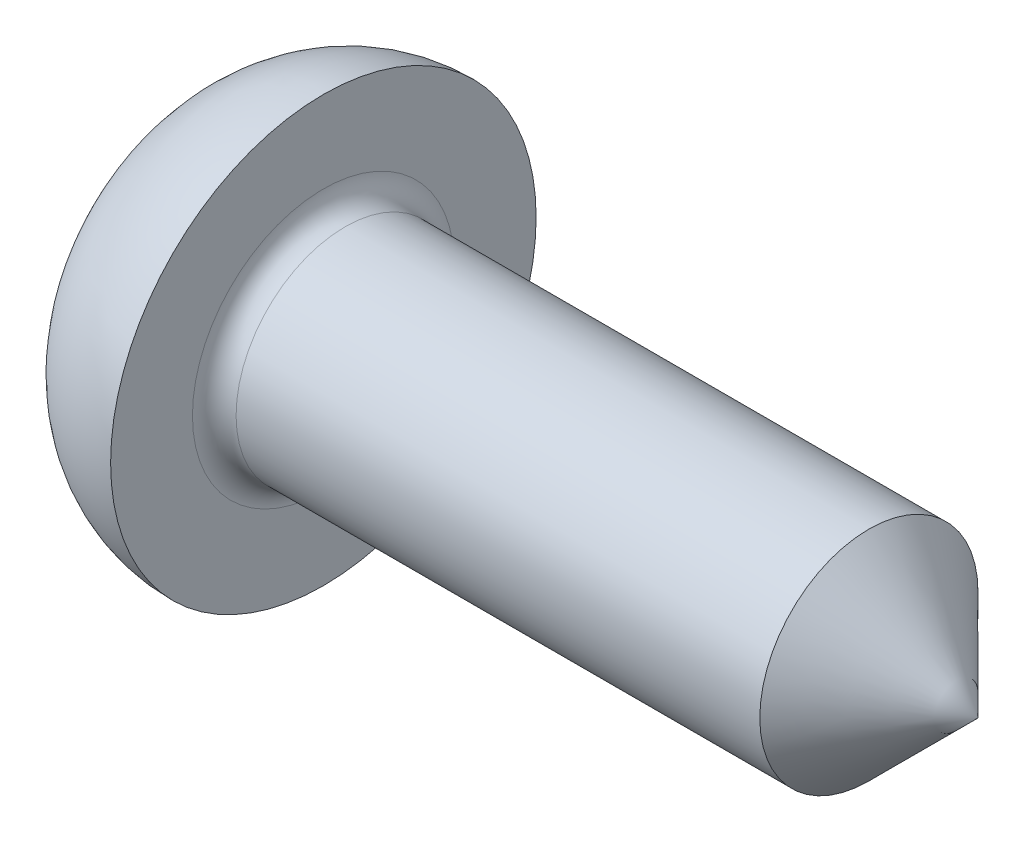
SolidWorks part; units mm, degrees
ref_plane "Front" through (0, 0, 0) normal (0, 0, 1) x (1, 0, 0)
ref_plane "Top" through (0, 0, 0) normal (0, 1, 0) x (1, 0, 0)
ref_plane "Right" through (0, 0, 0) normal (1, 0, 0) x (0, 0, -1)
sketch "Sketch1" plane through (0, 0, 0) normal (0, 1, 0) x (1, 0, 0)
  line L0 (-13.6293, 0) -> (11.3577, 0) construction
  line L1 (1.6, 1) -> (7.6, 1)
  line L2 (7.6, 1) -> (7.6, 0)
  line L3 (1.6, 1) -> (1.6, 1.95)
  line L4 (7.6, 0) -> (0, 0)
  arc A0 (1.6, 1.95) -> (0.4796, 1.4057) centre (1.5877, 0.5501) ccw
  arc A1 (0, 0) -> (0.4796, 1.4057) centre (2.3, 0) cw
  dimension "r2" = 1.4
  dimension "r1" = 2.3
  dimension "d" = 2
  dimension "dk" = 3.9
  dimension "k" = 1.6
  dimension "l" = 6
revolve "Revolve1" add sketch "Sketch1" angle 360 about L0
fillet "Fillet2" radius 0.2 1 edges at (1.6, 0, 1)
sketch "Sketch4" plane through (0, 0, 0) normal (0, 1, 0) x (1, 0, 0)
  line L0 (4.7828, 0) -> (7.1391, 0) construction
  line L2 (8.3335, 0) -> (8.3335, 21)
  line L3 (8.3335, 21) -> (-13.4, 21)
  line L4 (-13.4, 21) -> (7.6, 0)
  line L5 (7.6, 0) -> (8.3335, 0)
  line L7 (7.6, -1) -> (7.6, 1) construction
  dimension "D1" = 45
  dimension "D2" = 0.7335
  dimension "D3" = 21
revolve "Cut-Revolve1" cut sketch "Sketch4" angle 360 about L0
sketch "Sketch2" plane through (0, 0, 0) normal (1, 0, 0) x (0, 0, -1)
  line L0 (-2.278, 0) -> (2.6944, 0) construction
  line L1 (0, -2.1234) -> (0, 2.1948) construction
  line L2 (-0.3125, 0.3125) -> (-1.25, 0.3125)
  line L3 (0.3125, -1.25) -> (-0.3125, -1.25)
  line L4 (0.3125, -1.25) -> (0.3125, -0.3125)
  line L5 (0.3125, 1.25) -> (-0.3125, 1.25)
  line L6 (-0.3125, -1.25) -> (-0.3125, -0.3125)
  line L7 (1.25, 0.3125) -> (0.3125, 0.3125)
  line L8 (1.25, 0.3125) -> (1.25, -0.3125)
  line L9 (1.25, -0.3125) -> (0.3125, -0.3125)
  line L10 (-1.25, 0.3125) -> (-1.25, -0.3125)
  line L11 (-0.3125, 0.3125) -> (-0.3125, 1.25)
  line L12 (-0.3125, -0.3125) -> (-1.25, -0.3125)
  line L13 (0.3125, 0.3125) -> (0.3125, 1.25)
  point P19 (-0.3125, 0.3125)
  point P22 (0.3125, 0.3125)
  point P27 (-0.3125, -0.3125)
  dimension "m" = 2.5
  dimension "D2" = 2.5
  dimension "D3" = 0.625
  dimension "D4" = 0.625
ref_plane "Plane1" through (1.85, 0, 0) normal (1, 0, 0) x (0, 0, -1)
sketch "Sketch5" plane through (1.85, 0, 0) normal (1, 0, 0) x (0, 0, -1)
  point P0 (0, 0)
loft "Cut-Loft1" cut profiles "Sketch5", "Sketch2"
sketch "Sketch6" plane through (0, 0, 0) normal (0, 0, 1) x (1, 0, 0)
  line L0 (3.6, 1.2) -> (3.85, 1.2)
  line L1 (3.85, 1.2) -> (3.85, 1)
  line L2 (3.85, 1) -> (3.725, 0.7835)
  line L3 (3.6, 1) -> (3.725, 0.7835)
  line L4 (3.6, 1.2) -> (3.6, 1)
  line L5 (10.7743, 0) -> (0, 0) construction
  line L6 (3.6, 1) -> (3.85, 1) construction
  line L7 (3.725, 1) -> (3.725, 0.7835) construction
  line L8 (6.6, 1) -> (1.8, 1) construction
  point P5 (3.725, 1.2)
  dimension "D1" = 0.2
  dimension "D2" = 0.25
  dimension "D3" = 4
revolve "Cut-Revolve10" [suppressed] cut sketch "Sketch6" angle 360 about L5
pattern_linear "LPattern10" [suppressed] count 8 spacing 0.5 along (1, 0, 0)
equation "\"D4@Sketch2\" = \"D3@Sketch2\""
equation "\"D2@Sketch2\" = \"m@Sketch2\""
equation "\"D3@Sketch2\" = \"m@Sketch2\" / 4"
equation "\"D2@Sketch6\" = (  \"d@Sketch1\" - \"dm@ThreadCosmetic1\" )  / 2"
equation "\"D3@Sketch6\" = \"l0@ThreadCosmetic1\" + \"d@Sketch1\" / 2"
equation "\"D3@LPattern10\" = \"D2@Sketch6\" *2"
equation "\"D1@LPattern10\" = \"D3@Sketch6\" / \"D3@LPattern10\""
